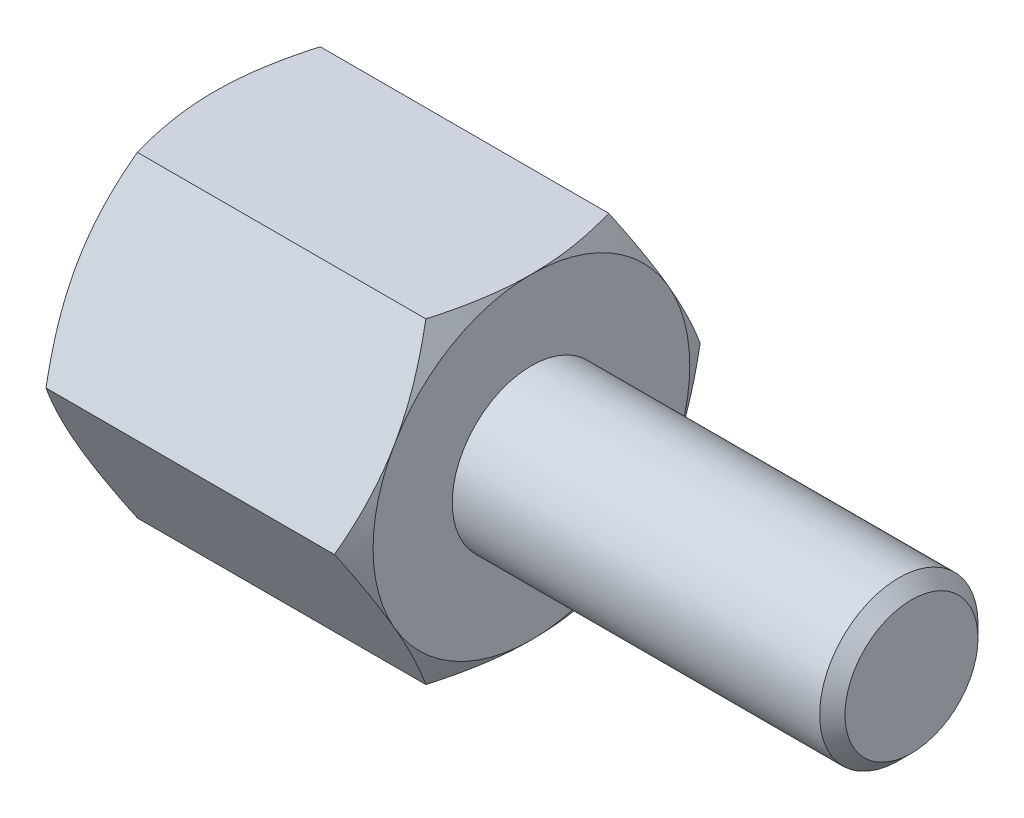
SolidWorks part; units mm, degrees
ref_plane "Front Plane" through (0, 0, 0) normal (0, 0, 1) x (1, 0, 0)
ref_plane "Top Plane" through (0, 0, 0) normal (0, 1, 0) x (1, 0, 0)
ref_plane "Right Plane" through (0, 0, 0) normal (1, 0, 0) x (0, 0, -1)
sketch "Sketch1" plane through (0, 0, 0) normal (1, 0, 0) x (0, 0, -1)
  line L1 (1.4434, 2.5) -> (-1.4434, 2.5)
  line L2 (-1.4434, 2.5) -> (-2.8868, 0)
  line L3 (-2.8868, 0) -> (-1.4434, -2.5)
  line L4 (-1.4434, -2.5) -> (1.4434, -2.5)
  line L5 (1.4434, -2.5) -> (2.8868, 0)
  line L6 (2.8868, 0) -> (1.4434, 2.5)
  circle A0 centre (0, 0) radius 2.5 construction
  dimension "D1" = 5
extrude "Extrude2" add sketch "Sketch1" along normal mid plane 5
sketch "Sketch2" plane through (0, 0, 0) normal (0, 0, 1) x (1, 0, 0)
  line L0 (-2.5, 2.5) -> (-1, 5.0981)
  line L1 (-2.5, 5.5) -> (-2.5, 2.5)
  line L3 (0, 0) -> (50000, 0) construction
  arc A0 (-1, 5.0981) -> (-2.5, 5.5) centre (-1.6962, 5.5) ccw
  dimension "D1" = 30
  dimension "D2" = 3
revolve "Cut-Revolve1" cut sketch "Sketch2" angle 360 about L3
mirror "Mirror1" about plane through (0, 0, 0) normal (1, 0, 0) of "Cut-Revolve1"
sketch "Sketch3" plane through (-2.5, 0, 0) normal (-1, 0, 0) x (0, 0, 1)
  circle A0 centre (0, 0) radius 1.05
  dimension "D1" = 2.1
extrude "Extrude3" cut sketch "Sketch3" against normal blind 2.5
sketch "Sketch4" plane through (0, 0, 0) normal (0, 0, 1) x (1, 0, 0)
  line L0 (0, 0) -> (0, 1.05)
  line L1 (2.2767, 0) -> (-2.2767, 0) construction
  line L2 (0, 1.05) -> (0.6062, 0)
  line L3 (0.6062, 0) -> (0, 0)
  line L4 (-2.5, 1.25) -> (-2.5, -1.25) construction
  point P4 (-2.5, 0)
  dimension "D1" = 30
  dimension "D2" = 1.05
  dimension "D3" = 2.5
revolve "Cut-Revolve2" cut sketch "Sketch4" angle 360 about L3
sketch "Sketch5" plane through (2.5, 0, 0) normal (1, 0, 0) x (0, 0, -1)
  circle A0 centre (0, 0) radius 1.25
  dimension "D1" = 2.5
extrude "Extrude4" add sketch "Sketch5" along normal blind 6
chamfer "Chamfer1" distance 0.2 angle 45 1 edges at (8.5, 0, -1.25)
equation "\"D2@Sketch4\" = \"D1@Sketch3\"/2"
